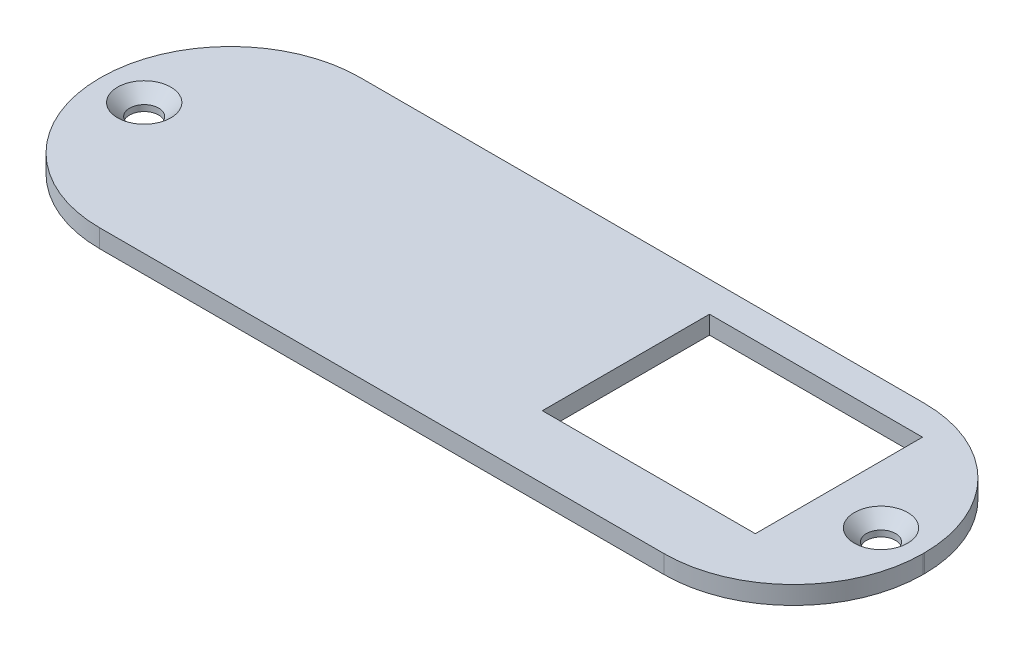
SolidWorks part; units mm, degrees
ref_plane "Front Plane" through (0, 0, 0) normal (0, 0, 1) x (1, 0, 0)
ref_plane "Top Plane" through (0, 0, 0) normal (0, 1, 0) x (1, 0, 0)
ref_plane "Right Plane" through (0, 0, 0) normal (1, 0, 0) x (0, 0, -1)
sketch "Sketch1" plane through (0, 0, 0) normal (0, 1, 0) x (1, 0, 0)
  line L1 (10.7, 0) -> (57.3, 0)
  line L2 (0, 10.7) -> (0, 10.8)
  line L3 (10.7, 21.5) -> (57.3, 21.5)
  line L4 (68, 10.7) -> (68, 10.8)
  arc A0 (10.7, 0) -> (0, 10.7) centre (10.7, 10.7) cw
  arc A1 (0, 10.8) -> (10.7, 21.5) centre (10.7, 10.8) cw
  arc A2 (57.3, 0) -> (68, 10.7) centre (57.3, 10.7) ccw
  arc A3 (57.3, 21.5) -> (68, 10.8) centre (57.3, 10.8) cw
  point P7 (0, 0)
  dimension "D1" = 10.7
  dimension "D2" = 10.7
extrude "Boss-Extrude1" add sketch "Sketch1" along normal blind 1.5
hole_wizard "CSK for M2 Flat Head Machine Screw1" positions "Sketch3" profile "Sketch4" countersink size "M2" standard "ANSI Metric"
sketch "Sketch3" plane through (0, 1.5, 0) normal (0, 1, 0) x (1, 0, 0)
  point P0 (3.578, 10.8)
  point P2 (64.4236, 10.8)
sketch "Sketch4" plane through (3.578, 1.5, -10.8) normal (1, 0, 0) x (0, 0, 1)
  line L0 (0, 0) -> (0, 1.5)
  line L1 (0, 1.5) -> (1.2, 1.5)
  line L2 (1.2, 1.5) -> (1.2, 1)
  line L3 (1.2, 1) -> (2.2, 0)
  line L5 (2.2, 0) -> (0, 0)
  line L6 (-1.2, 1) -> (-2.2, 0) construction
  line L11 (0, -6.35) -> (0, 107.95) construction
  dimension "Thru Hole Dia." = 2.4
  dimension "Thru Hole Depth" = 1.5
  dimension "Near C'Sink Dia." = 4.4
  dimension "Near C'Sink Angle" = 90
sketch "Sketch5" plane through (0, 1.5, 0) normal (0, 1, 0) x (1, 0, 0)
  line L5 (59.65, 19) -> (42.0599, 19)
  line L6 (59.65, 19) -> (59.65, 5.1947)
  line L7 (59.65, 5.1947) -> (42.0599, 5.1947)
  line L8 (42.0599, 19) -> (42.0599, 5.1947)
extrude "Cut-Extrude1" cut sketch "Sketch5" against normal blind 1.5
